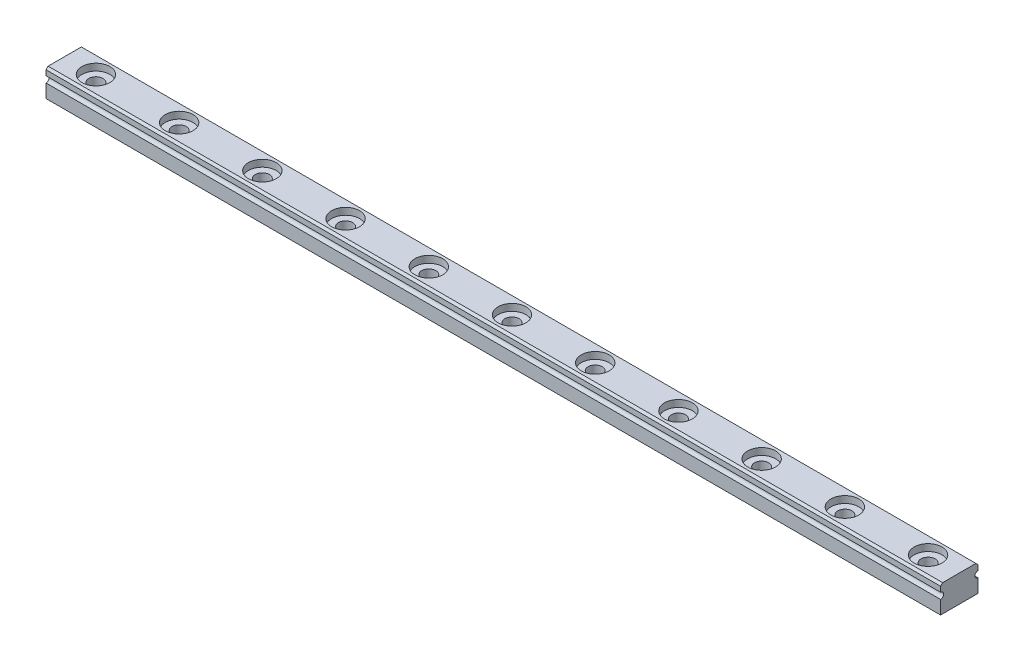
SolidWorks part; units mm, degrees
ref_plane "Ebene vorne" through (0, 0, 0) normal (0, 0, 1) x (1, 0, 0)
ref_plane "Ebene oben" through (0, 0, 0) normal (0, 1, 0) x (1, 0, 0)
ref_plane "Ebene rechts" through (0, 0, 0) normal (1, 0, 0) x (0, 0, -1)
sketch "Skizze1" plane through (0, 0, 0) normal (1, 0, 0) x (0, 0, -1)
  line L0 (-4.5, 0.75) -> (4.5, 0.75) construction
  line L1 (4.5, -3.25) -> (-4.5, -3.25)
  line L2 (4.5, -3.25) -> (4.5, 0)
  line L3 (4.5, 3.25) -> (-4.5, 3.25)
  line L4 (-4.5, -3.25) -> (-4.5, 0)
  line L5 (4.5, -3.25) -> (-4.5, 3.25) construction
  line L6 (4.5, 3.25) -> (-4.5, -3.25) construction
  line L7 (-4.5, 1.5) -> (-4.5, 3.25)
  line L8 (4.5, 1.5) -> (4.5, 3.25)
  arc A0 (-4.5, 0) -> (-4.5, 1.5) centre (-4.5, 0.75) ccw
  arc A1 (4.5, 1.5) -> (4.5, 0) centre (4.5, 0.75) ccw
  point P0 (0, 0)
  dimension "D4" = 0.75
  dimension "D5" = 0.75
  dimension "D1" = 9
  dimension "D2" = 6.5
  dimension "D3" = 2.5
extrude "Aufsatz-Linear austragen1" add sketch "Skizze1" along normal blind 215
chamfer "Fase1" distance 0.5 angle 45 2 edges at (107.5, 3.25, -4.5) (107.5, 3.25, 4.5)
sketch "Skizze2" plane through (0, 3.25, 0) normal (0, 1, 0) x (1, 0, 0)
  line L0 (215, 0) -> (0, 0) construction
  line L1 (215, 4) -> (215, -4) construction
  point P5 (67.5, 0)
  point P6 (107.5, 0)
  point P7 (87.5, 0)
  point P8 (127.5, 0)
  point P9 (147.5, 0)
  dimension "D3" = 20
  dimension "D1" = 20
  dimension "D2" = 20
  dimension "D4" = 20
ref_plane "Mitte Schiene" through (107.5, 0, 0) normal (1, 0, 0) x (0, 0, -1)
ref_plane "Plane1" through (207.5, 0, 0) normal (1, 0, 0) x (0, 0, -1)
sketch "Sketch3" plane through (0, 3.25, 0) normal (0, 1, 0) x (1, 0, 0)
  line L0 (215, 4) -> (215, -4) construction
  line L1 (0, -4) -> (215, -4) construction
  point P0 (207.5, 0)
  point P16 (187.5, 0)
  point P17 (167.5, 0)
  point P18 (147.5, 0)
  point P19 (127.5, 0)
  point P20 (107.5, 0)
  point P21 (87.5, 0)
  point P22 (67.5, 0)
  point P23 (47.5, 0)
  point P24 (27.5, 0)
  point P25 (7.5, 0)
  dimension "D1" = 7.5
  dimension "D2" = 4
  dimension "D3" = 11
hole_wizard "CBORE for M3 SBHCS1" positions "Sketch3" profile "Sketch4" counterbore size "M3" standard "ANSI Metric"
sketch "Sketch4" plane through (207.5, 3.25, 0) normal (1, 0, 0) x (0, 0, 1)
  line L0 (0, 0) -> (0, 6.5)
  line L1 (0, 6.5) -> (1.7, 6.5)
  line L3 (1.7, 6.5) -> (1.7, 1.65)
  line L4 (1.7, 1.65) -> (3.35, 1.65)
  line L5 (3.35, 1.65) -> (3.35, 0)
  line L7 (3.35, 0) -> (0, 0)
  line L11 (0, -6.35) -> (0, 107.95) construction
  dimension "Thru Hole Dia." = 3.4
  dimension "Thru Hole Depth" = 6.5
  dimension "C'Bore Dia." = 6.7
  dimension "C'Bore Depth" = 1.65
